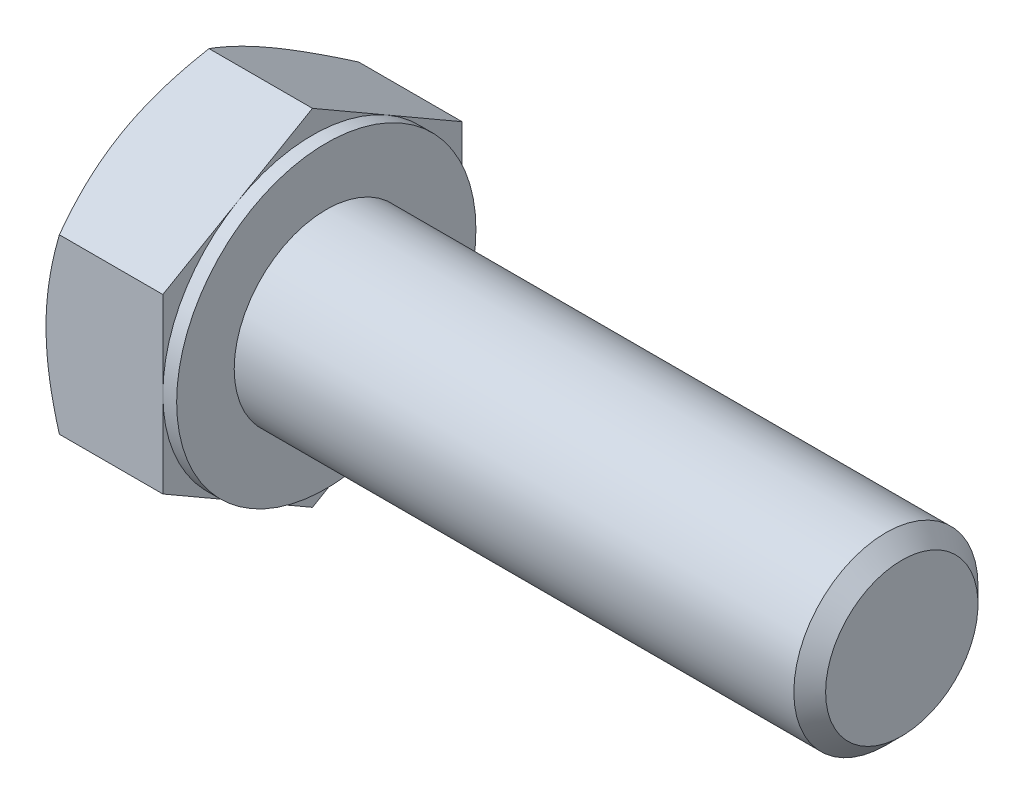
SolidWorks part; units mm, degrees
ref_plane "Plane1" through (0, 0, 0) normal (0, 0, 1) x (1, 0, 0)
ref_plane "Plane2" through (0, 0, 0) normal (0, 1, 0) x (1, 0, 0)
ref_plane "Plane3" through (0, 0, 0) normal (1, 0, 0) x (0, 0, -1)
extrude "BaseHead" add sketch "Sketch1" along normal blind 5.675
sketch "Sketch1" plane through (0, 0, 0) normal (1, 0, 0) x (0, 0, -1)
  line L0 (6.5, 3.7528) -> (6.5, -3.7528)
  line L1 (-6.5, 3.7528) -> (-6.5, -3.7528)
  line L2 (6.5, -3.7528) -> (0, -7.5056)
  line L3 (0, -7.5056) -> (-6.5, -3.7528)
  line L4 (6.5, 3.7528) -> (0, 7.5056)
  line L5 (0, 7.5056) -> (-6.5, 3.7528)
  dimension "Width_flats" = 13
  dimension "D2" = 120
  dimension "D3" = 6.5
  dimension "D4" = 6.5
  dimension "D5" = 6.5
revolve "BaseBody" add sketch "BodySke"
sketch "BodySke" plane through (0, 0, 0) normal (0, 0, 1) x (1, 0, 0)
  line L0 (0, 3.7528) -> (0, -3.7528) construction
  line L1 (0, 0) -> (30.675, 0)
  line L2 (0, 0) -> (0, 4)
  line L3 (0, 4) -> (29.9845, 4)
  line L4 (30.675, 0) -> (30.675, 3.3095)
  line L5 (5.675, 7.5056) -> (5.675, 3.7528) construction
  line L6 (30.675, 3.3095) -> (29.9845, 4)
  line L7 (0, 0) -> (96.52, 0) construction
  line L8 (30.675, -3.3095) -> (29.9845, -4) construction
  line L9 (0, -4) -> (29.9845, -4) construction
  line L10 (6.925, 15.24) -> (6.925, -1.27) construction
  line L12 (5.675, 3.7528) -> (5.675, -3.7528) construction
  dimension "Length" = 25
  dimension "Body_ch_ang" = 45
  dimension "Diameter" = 8
  dimension "Minor_dia" = 6.619
  dimension "Advance" = 1.25
fillet "HeadFillet" [suppressed] radius 0.4
sketch "Sketch3" plane through (0, 0, 0) normal (0, 0, 1) x (1, 0, 0)
  line L0 (0, 6.5) -> (3.4673, 12.5056)
  line L1 (0, 7.5056) -> (0, 3.7528) construction
  line L2 (3.4673, 12.5056) -> (3.4673, 17.5056)
  line L3 (3.4673, 17.5056) -> (-10, 17.5056)
  line L4 (-10, 17.5056) -> (-10, 6.5)
  line L5 (-10, 6.5) -> (0, 6.5)
  line L6 (0, 0) -> (99.06, 0) construction
  line L7 (5.675, 7.5056) -> (0, 7.5056) construction
  dimension "D1" = 6.5
  dimension "D2" = 5
  dimension "D3" = 10
  dimension "D4" = 5
  dimension "Head_ch_ang" = 30
revolve "HeadChamfer" cut sketch "Sketch3" angle 360 about L6
sketch "Sketch4" plane through (0, 0, 0) normal (0, 0, 1) x (1, 0, 0)
  line L1 (5.675, 7.5056) -> (5.675, 3.7528) construction
  line L2 (5.675, 6.5) -> (5.075, 6.5)
  line L3 (5.675, 6.5) -> (5.675, 17.5056)
  line L4 (5.675, 17.5056) -> (5.075, 17.5056)
  line L5 (0, 0) -> (95.25, 0) construction
  line L6 (0, 0) -> (96.52, 0) construction
  line L7 (5.075, 6.5) -> (5.075, 17.5056)
  line L8 (5.675, 7.5056) -> (0.5806, 7.5056) construction
  dimension "D1" = 13
  dimension "D2" = 10
  dimension "Bearing_ht" = 0.6
revolve "BearingFace" cut sketch "Sketch4" angle 360 about L5
sketch "ThdSchSke" plane through (0, 0, 0) normal (0, 0, 1) x (1, 0, 0)
  line L0 (6.925, -3.3095) -> (6.4415, -4)
  line L1 (6.925, -3.3095) -> (7.4085, -4)
  line L2 (7.4085, -4) -> (7.4085, -5)
  line L3 (-3.175, 0) -> (5.1513, 0) construction
  line L5 (7.4085, -5) -> (6.4415, -5)
  line L6 (6.4415, -5) -> (6.4415, -4)
  dimension "Thread_minor" = 6.619
  dimension "Diameter" = 8
  dimension "Start" = 6.925
  dimension "SideAngle" = 55
  dimension "VeeAngle" = 70
  dimension "Overcut" = 10
revolve "ThreadSchematic" [suppressed] cut sketch "ThdSchSke" angle 360 about L3
pattern_linear "ThdSchPat" [suppressed]
equation "\"D3@Sketch1\" = \"Width_flats@Sketch1\" / 2"
equation "\"D4@Sketch1\" = \"D3@Sketch1\""
equation "\"D5@Sketch1\" = \"D4@Sketch1\""
equation "\"Thread_minor@ThreadCosmetic\" = \"Minor_dia@BodySke\""
equation "\"D1@Sketch3\" = \"Width_flats@Sketch1\" / 2"
equation "\"D1@Sketch4\" = \"Width_flats@Sketch1\""
equation "\"Thread_length@ThreadCosmetic\" = \"Length@BodySke\" - \"Advance@BodySke\""
equation "\"Thread_minor@ThdSchSke\" = \"Minor_dia@BodySke\""
equation "\"Diameter@ThdSchSke\" = \"Diameter@BodySke\""
equation "\"Overcut@ThdSchSke\" = \"Diameter@BodySke\" * 1.25"
equation "\"Start@ThdSchSke\" = \"Head_ht@BaseHead\" + \"Length@BodySke\" - \"Thread_length@ThreadCosmetic\"  '---Non-countersunk---"
equation "\"Num_threads@ThdSchPat\" = int( \"Thread_length@ThreadCosmetic\" / \"Advance@BodySke\" + 0.999 )  + 1"
equation "\"Advance@ThdSchPat\" = \"Thread_length@ThreadCosmetic\" /  (\"Num_threads@ThdSchPat\" - 1) 'relax it"
equation "\"Num_threads@ThdSchPat\" = \"Num_threads@ThdSchPat\" - sgn( \"Num_threads@ThdSchPat\" - 1) '---chamfered tips only---"
